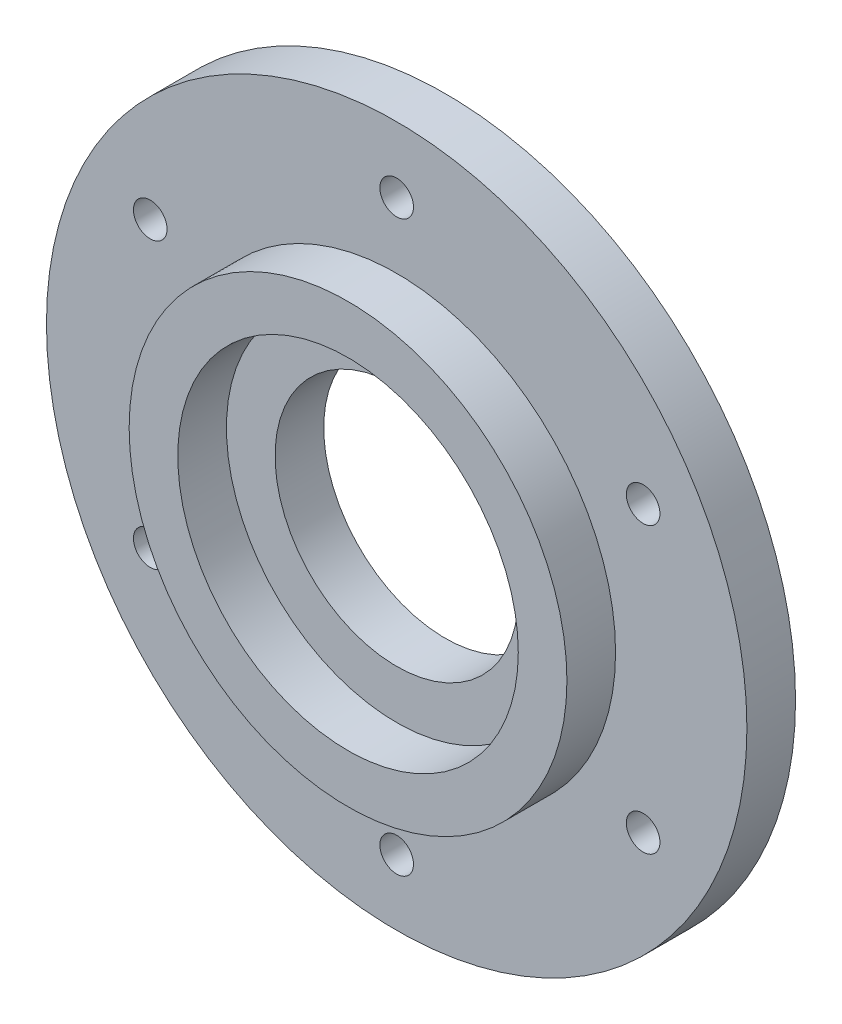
SolidWorks part; units mm, degrees
ref_plane "Front Plane" through (0, 0, 0) normal (0, 0, 1) x (1, 0, 0)
ref_plane "Top Plane" through (0, 0, 0) normal (0, 1, 0) x (1, 0, 0)
ref_plane "Right Plane" through (0, 0, 0) normal (1, 0, 0) x (0, 0, -1)
sketch "Sketch Spindle Skeleton" plane through (0, 0, 0) normal (1, 0, 0) x (0, 0, -1)
  line L5 (-1000, 0) -> (49000, 0)
  line L6 (0, -9.5) -> (0, 9.5)
  line L13 (0, 9.5) -> (-48.3, 9.5)
  line L26 (-48.3, 9.5) -> (-48.3, 14)
  line L27 (-48.3, 14) -> (-119.9, 14)
  line L32 (-119.9, 14) -> (-119.9, 9.5)
  line L33 (-119.9, 9.5) -> (-160, 9.5)
  line L34 (-160, 9.5) -> (-160, -9.5)
  line L35 (-160, -9.5) -> (-119.9, -9.5)
  line L36 (-119.9, -9.5) -> (-119.9, -14)
  line L37 (-119.9, -14) -> (-48.3, -14)
  line L38 (-48.3, -14) -> (-48.3, -9.5)
  line L39 (0, -9.5) -> (-48.3, -9.5)
  line L40 (-24.2, 36) -> (-19.2, 36)
  line L41 (-136.5, 22.5) -> (-119.9, 22.5)
  line L42 (-136.5, 22.5) -> (-136.5, -22.5)
  line L43 (-136.5, -22.5) -> (-119.9, -22.5)
  line L44 (-119.9, 22.5) -> (-119.9, -22.5)
  line L45 (-136.5, 22.5) -> (-119.9, -22.5) construction
  line L46 (-136.5, -22.5) -> (-119.9, 22.5) construction
  line L47 (-31.7, 22.5) -> (-48.3, 22.5)
  line L48 (-31.7, 22.5) -> (-31.7, -22.5)
  line L49 (-31.7, -22.5) -> (-48.3, -22.5)
  line L50 (-48.3, 22.5) -> (-48.3, -22.5)
  line L51 (-31.7, 22.5) -> (-48.3, -22.5) construction
  line L52 (-31.7, -22.5) -> (-48.3, 22.5) construction
  line L59 (-19.2, 36) -> (-19.2, -36)
  line L60 (-19.2, -36) -> (-24.2, -36)
  line L61 (-24.2, -22.5) -> (-29.2, -22.5)
  line L62 (-29.2, -22.5) -> (-29.2, -17.5)
  line L63 (-29.2, -17.5) -> (-24.2, -17.5)
  line L64 (-24.2, -17.5) -> (-24.2, 17.5)
  line L65 (-24.2, 17.5) -> (-29.2, 17.5)
  line L66 (-29.2, 17.5) -> (-29.2, 22.5)
  line L67 (-29.2, 22.5) -> (-24.2, 22.5)
  line L68 (-24.2, 22.5) -> (-24.2, 36)
  line L69 (-24.2, -22.5) -> (-24.2, -36)
  line L71 (-141.5, 36) -> (-25.2, 36)
  line L72 (-141.5, 36) -> (-141.5, -36)
  line L73 (-141.5, -36) -> (-25.2, -36)
  line L74 (-25.2, 36) -> (-25.2, -36)
  line L75 (-141.5, 36) -> (-25.2, -36) construction
  line L76 (-141.5, -36) -> (-25.2, 36) construction
  point P3 (0, 0)
  point P18 (-128.2, 0)
  point P24 (-40, 0)
  point P29 (-83.35, 0)
  point P48 (-19.2, 29.25)
revolve "Main Revolve" add sketch "Sketch Spindle Skeleton" angle 360 about L5
sketch "Sketch Center Cut" plane through (0, 0, 24.2) normal (0, 0, 1) x (1, 0, 0)
  circle A0 centre (0, 0) radius 17.5 construction
  circle A1 centre (0, 0) radius 17.5 construction
  circle A2 centre (0, 0) radius 12.5
  dimension "D1" = 5
extrude "Cut Center" cut sketch "Sketch Center Cut" against normal through all
hole_wizard "CBORE for #5 Binding Head Machine Screw1" positions "Hole wizard sketch 1" profile "Hole wizard sketch 2" counterbore size "#5" standard "ANSI Inch"
sketch "Hole wizard sketch 1" plane through (0, 0, 19.2) normal (0, 0, -1) x (-1, 0, 0)
  point P0 (0, 29.25)
sketch "Hole wizard sketch 2" plane through (0, 29.25, 19.2) normal (1, 0, 0) x (0, 1, 0)
  line L0 (0, 0) -> (0, 10)
  line L1 (0, 10) -> (1.7272, 10)
  line L3 (1.7272, 10) -> (1.7272, 1.9812)
  line L4 (1.7272, 1.9812) -> (3.7706, 1.9812)
  line L5 (3.7706, 1.9812) -> (3.7706, 0)
  line L7 (3.7706, 0) -> (0, 0)
  line L11 (0, -6.35) -> (0, 107.95) construction
  dimension "Thru Hole Dia." = 3.4544
  dimension "Thru Hole Depth" = 10
  dimension "C'Bore Dia." = 7.5413
  dimension "C'Bore Depth" = 1.9812
pattern_circular "CirPattern1" count 6 over 360 about axis through (0, 0, 0) along (0, 0, 1) of "CBORE for #5 Binding Head Machine Screw1"
